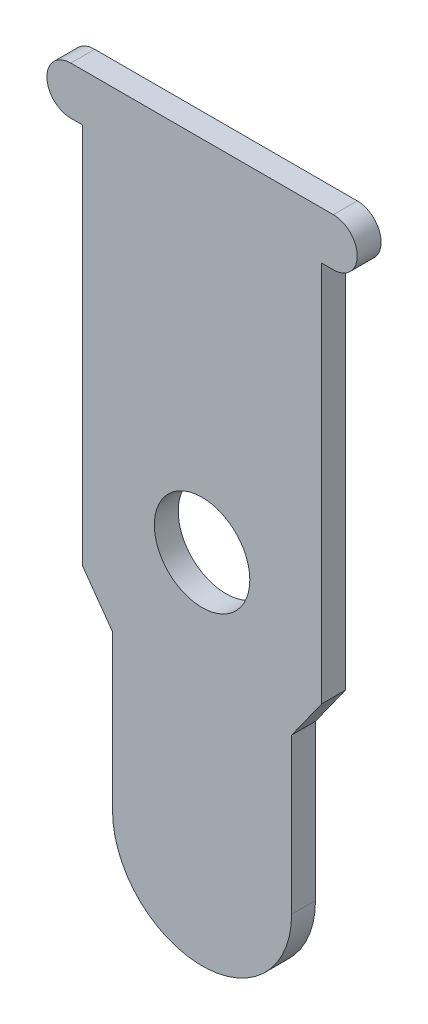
SolidWorks part; units mm, degrees
ref_plane "Front Plane" through (0, 0, 0) normal (0, 0, 1) x (1, 0, 0)
ref_plane "Top Plane" through (0, 0, 0) normal (0, 1, 0) x (1, 0, 0)
ref_plane "Right Plane" through (0, 0, 0) normal (1, 0, 0) x (0, 0, -1)
sketch "Sketch1" plane through (0, 0, 0) normal (0, 0, 1) x (1, 0, 0)
  line L0 (0, 36.7916) -> (0, -47.0044) construction
  line L2 (11, 26) -> (10, 26)
  line L3 (10, 26) -> (10, -6)
  line L4 (10, -6) -> (7.5, -9.5)
  line L5 (7.5, -9.5) -> (7.5, -22.5)
  line L6 (-7.5, -9.5) -> (-7.5, -22.5)
  line L7 (-10, -6) -> (-7.5, -9.5)
  line L8 (-10, 26) -> (-10, -6)
  line L9 (-11, 26) -> (-10, 26)
  line L11 (-11, 30) -> (11, 30)
  circle A0 centre (0, 0) radius 4
  arc A1 (7.5, -22.5) -> (-7.5, -22.5) centre (0, -22.5) cw
  arc A2 (11, 30) -> (11, 26) centre (11, 28) cw
  arc A3 (-11, 30) -> (-11, 26) centre (-11, 28) ccw
  dimension "D1" = 8
  dimension "D2" = 30
  dimension "D3" = 7.5
  dimension "D6" = 2
  dimension "D4" = 22
  dimension "D5" = 13
  dimension "D7" = 32
  dimension "D8" = 20
extrude "Boss-Extrude1" add sketch "Sketch1" along normal blind 2
